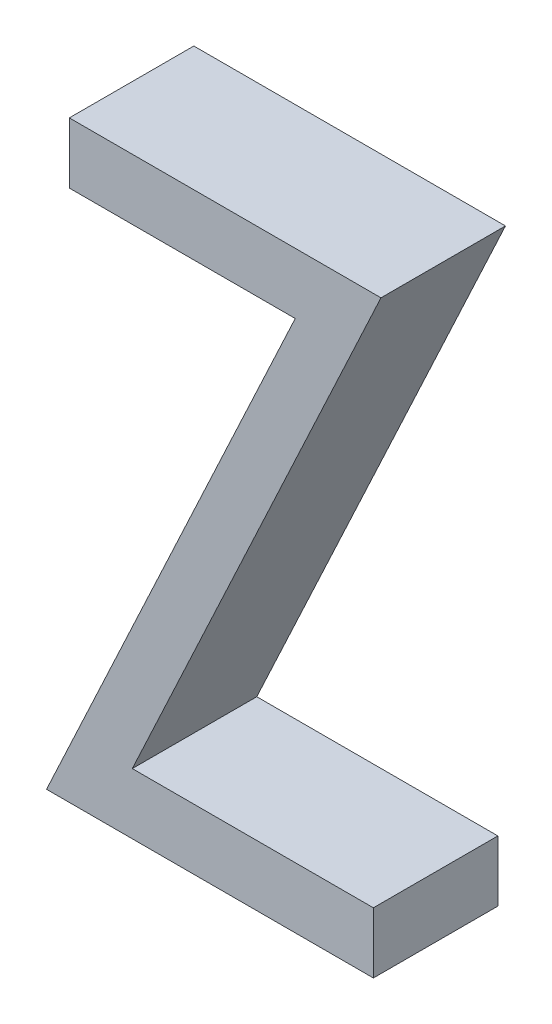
SolidWorks part; units mm, degrees
ref_plane "Face" through (0, 0, 0) normal (0, 0, 1) x (1, 0, 0)
ref_plane "Dessus" through (0, 0, 0) normal (0, 1, 0) x (1, 0, 0)
ref_plane "Droite" through (0, 0, 0) normal (1, 0, 0) x (0, 0, -1)
sketch "Esquisse1" plane through (0, 0, 0) normal (0, 0, 1) x (1, 0, 0)
  text T0 "Z" font "Century Gothic" height in points 72
extrude "Boss.-Extru.1" add sketch "Esquisse1" along normal mid plane 4
